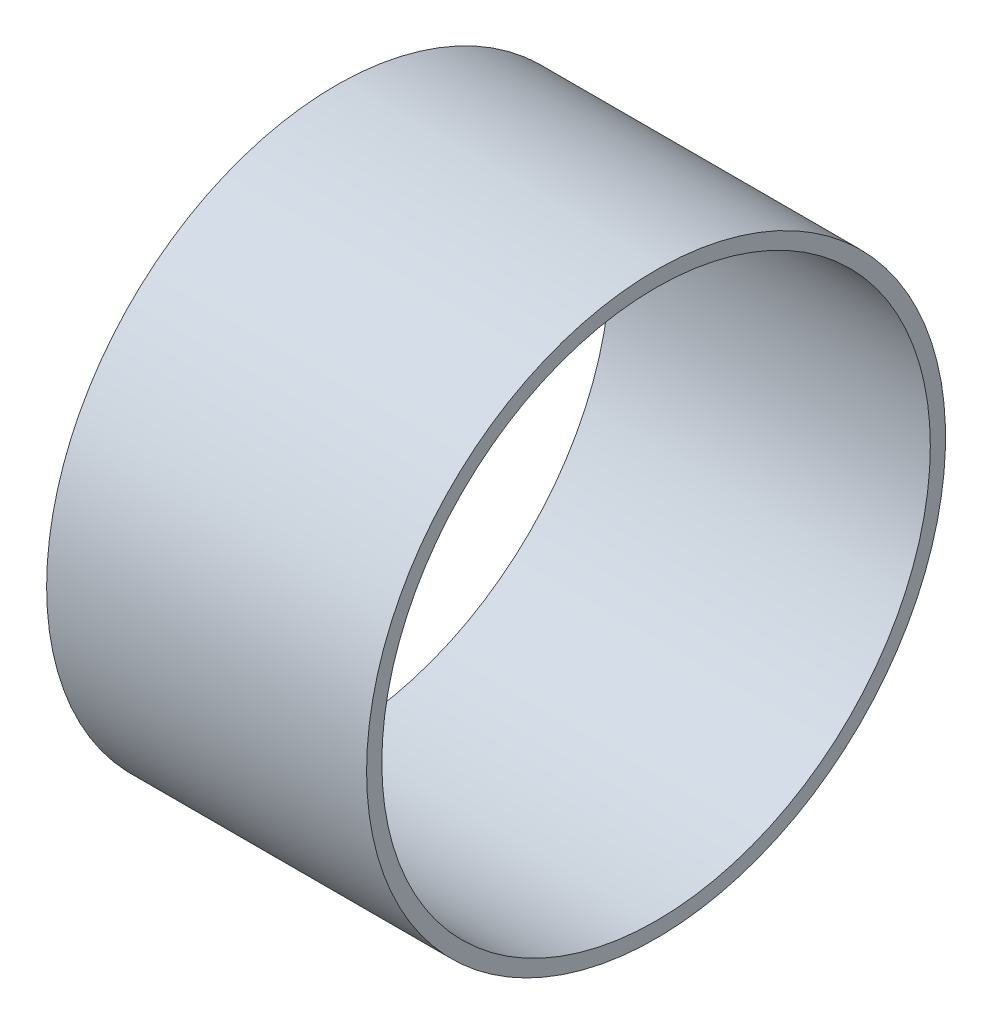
SolidWorks part; units mm, degrees
ref_plane "Plan de face" through (0, 0, 0) normal (0, 0, 1) x (1, 0, 0)
ref_plane "Plan de dessus" through (0, 0, 0) normal (0, 1, 0) x (1, 0, 0)
ref_plane "Plan de droite" through (0, 0, 0) normal (1, 0, 0) x (0, 0, -1)
ref_plane "Plan4" through (0, 0, 0) normal (0, 0, -1) x (-1, 0, 0)
sketch "Esquisse1" plane through (0, 0, 0) normal (0, 0, -1) x (-1, 0, 0)
  line L0 (-42, 38) -> (-42, 36)
  line L1 (-42, 36) -> (0, 36)
  line L2 (0, 36) -> (0, 38)
  line L3 (0, 38) -> (-42, 38)
  line L4 (-42, 0) -> (0, 0) construction
revolve "Révolution1" add sketch "Esquisse1" angle 360 about L4
